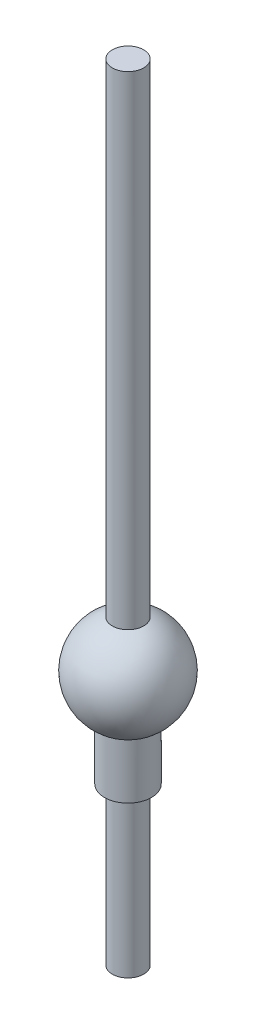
SolidWorks part; units mm, degrees
ref_plane "Front Plane" through (0, 0, 0) normal (0, 0, 1) x (1, 0, 0)
ref_plane "Top Plane" through (0, 0, 0) normal (0, 1, 0) x (1, 0, 0)
ref_plane "Right Plane" through (0, 0, 0) normal (1, 0, 0) x (0, 0, -1)
sketch "Sketch1" plane through (0, 0, 0) normal (0, 0, 1) x (1, 0, 0)
  line L0 (0, 0) -> (2, 0)
  line L1 (2, 0) -> (2, 20)
  line L2 (2, 20) -> (3, 20)
  line L3 (3, 20) -> (3, 27.0171)
  line L4 (2, 100) -> (0, 100)
  line L5 (0, 0) -> (0, 100) construction
  line L6 (0, 0) -> (0, 100)
  line L7 (2, 38.4214) -> (2, 100)
  arc A0 (3, 27.0171) -> (2, 38.4214) centre (0, 32.5) ccw
  dimension "D6" = 12.5
  dimension "D1" = 2
  dimension "D2" = 20
  dimension "D3" = 1
  dimension "D4" = 80
  dimension "D5" = 2
  dimension "D7" = 12.5
revolve "Revolve1" add sketch "Sketch1" angle 360 about L5
